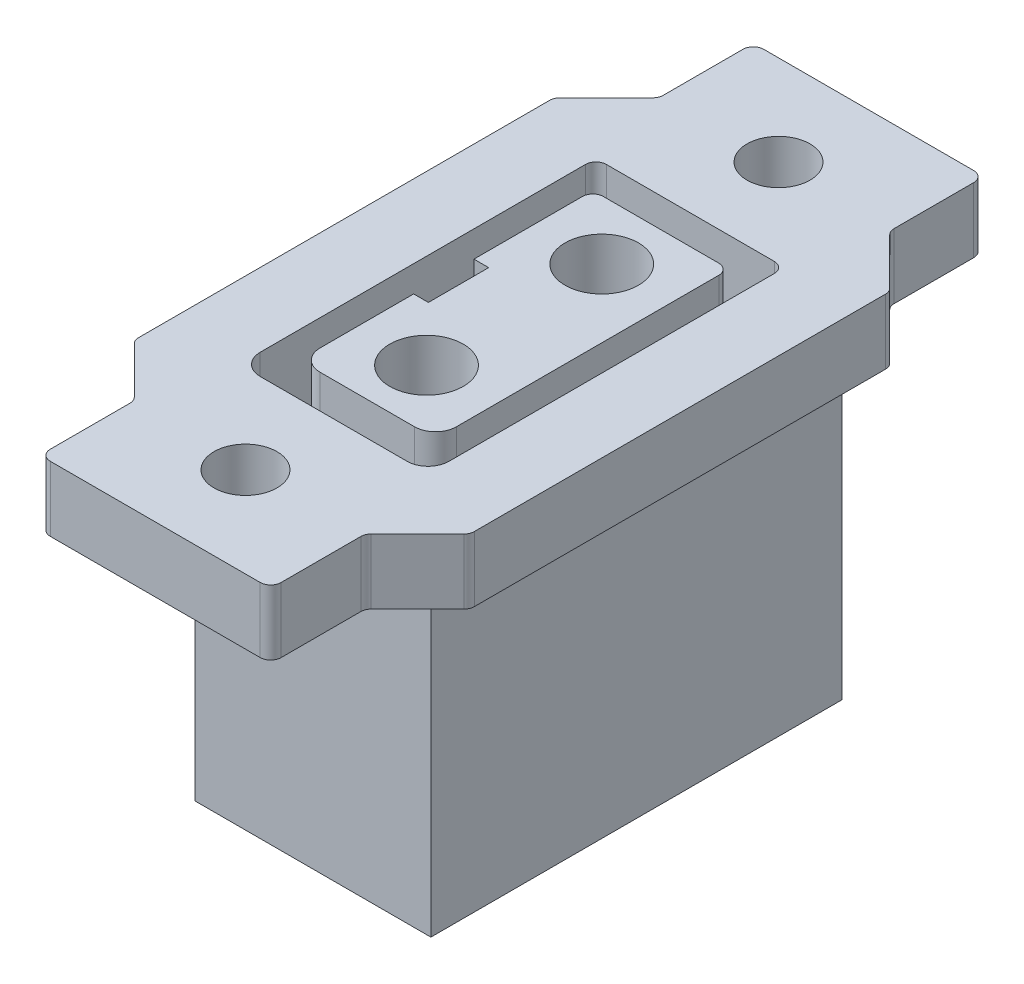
SolidWorks part; units mm, degrees
ref_plane "Front Plane" through (0, 0, 0) normal (0, 0, 1) x (1, 0, 0)
ref_plane "Top Plane" through (0, 0, 0) normal (0, 1, 0) x (1, 0, 0)
ref_plane "Right Plane" through (0, 0, 0) normal (1, 0, 0) x (0, 0, -1)
sketch "Sketch1" plane through (0, 0, 0) normal (0, 1, 0) x (1, 0, 0)
  line L0 (8, 34) -> (8, 29.7) construction
  line L7 (8, 0) -> (8, 4.3) construction
  line L8 (4.75, 24.1046) -> (4.75, 18.4368)
  line L9 (4.75, 18.4368) -> (5.4524, 18.4368)
  line L10 (5.4524, 18.4368) -> (5.4524, 15.5632)
  line L11 (5.4524, 15.5632) -> (4.75, 15.5632)
  line L12 (4.75, 15.5632) -> (4.75, 11.1025)
  line L13 (0, 34) -> (16, 34) construction
  line L14 (16, 0) -> (16, 34) construction
  line L15 (0, 0) -> (16, 0) construction
  line L20 (0, 0) -> (0, 34) construction
  line L21 (3.5, 25.5) -> (12.5, 25.5)
  line L22 (3.5, 25.5) -> (3.5, 9.5)
  line L23 (4.5, 8.5) -> (11.5, 8.5)
  line L24 (12.5, 25.5) -> (12.5, 9.5)
  line L25 (3.5, 25.5) -> (12.5, 8.5) construction
  line L26 (3.5, 8.5) -> (12.5, 25.5) construction
  line L28 (2.5, 29.5) -> (2.5, 34)
  line L29 (4.75, 24.1046) -> (11.25, 24.1046)
  line L31 (5.75, 10.1025) -> (10.25, 10.1025)
  line L32 (11.25, 24.1046) -> (11.25, 11.1025)
  line L33 (4.75, 24.1046) -> (11.25, 10.1025) construction
  line L34 (4.75, 10.1025) -> (11.25, 24.1046) construction
  line L35 (2.5, 34) -> (13.5, 34)
  line L36 (13.5, 34) -> (13.5, 29.5)
  line L37 (13.5, 29.5) -> (16, 27)
  line L40 (13.5, 4.5) -> (13.5, 0)
  line L41 (13.5, 0) -> (2.5, 0)
  line L42 (2.5, 0) -> (2.5, 4.5)
  line L46 (2.5, 29.5) -> (0, 27)
  line L47 (0, 27) -> (0, 7)
  line L48 (0, 7) -> (2.5, 4.5)
  line L49 (13.5, 4.5) -> (16, 7)
  line L50 (16, 7) -> (16, 27)
  circle A0 centre (8, 29.7) radius 1.5
  circle A1 centre (8, 4.3) radius 1.5
  circle A3 centre (8, 21.2778) radius 1.75
  circle A4 centre (8, 12.9262) radius 1.75
  arc A5 (3.5, 9.5) -> (4.5, 8.5) centre (4.5, 9.5) ccw
  arc A6 (11.5, 8.5) -> (12.5, 9.5) centre (11.5, 9.5) ccw
  arc A7 (10.25, 10.1025) -> (11.25, 11.1025) centre (10.25, 11.1025) ccw
  arc A8 (4.75, 11.1025) -> (5.75, 10.1025) centre (5.75, 11.1025) ccw
  point P0 (0, 0)
  point P1 (8, 0)
  point P4 (8, 17)
  point P22 (8, 24.1046)
  point P23 (8, 25.5)
  point P24 (5.4524, 17)
  point P33 (8, 17)
  point P42 (8, 17.1035)
  point P55 (8, 17)
  dimension "D3" = 3
  dimension "D4" = 9
  dimension "D6" = 3.5
  dimension "D10" = 1
  dimension "D11" = 1
  dimension "D12" = 1
  dimension "D13" = 1
  dimension "D2" = 34
  dimension "D5" = 6.5
  dimension "D7" = 2.8737
  dimension "D8" = 0.7024
  dimension "D9" = 4.3
  dimension "D15" = 4.5
  dimension "D16" = 7
  dimension "D17" = 45
  dimension "D14" = 16
extrude "Boss-Extrude2" add sketch "Sketch1" along normal blind 3.1
fillet "Fillet1" radius 0.5 12 edges at (0, 1.55, -7) (2.5, 1.55, -4.5) (2.5, 1.55, 0) (13.5, 1.55, 0) (13.5, 1.55, -4.5) (16, 1.55, -7) (16, 1.55, -27) (13.5, 1.55, -29.5) (13.5, 1.55, -34) (2.5, 1.55, -34) (0, 1.55, -27) (2.5, 1.55, -29.5)
sketch "Sketch4" plane through (0, 0, 0) normal (0, -1, 0) x (1, 0, 0)
  line L0 (5.75, -10.1025) -> (10.25, -10.1025) construction
  line L1 (13.6048, -27.1101) -> (2.3623, -27.1101)
  line L2 (13.6048, -27.1101) -> (13.6048, -7.53)
  line L3 (13.6048, -7.53) -> (2.3623, -7.53)
  line L4 (2.3623, -27.1101) -> (2.3623, -7.53)
  line L5 (13.6048, -27.1101) -> (2.3623, -7.53) construction
  line L6 (13.6048, -7.53) -> (2.3623, -27.1101) construction
  line L7 (4.5, -8.5) -> (11.5, -8.5) construction
  line L8 (5.75, -10.1025) -> (10.25, -10.1025)
  line L9 (4.5, -8.5) -> (11.5, -8.5)
  line L10 (4.75, -11.1025) -> (4.75, -15.5632) construction
  line L11 (4.75, -15.5632) -> (5.4524, -15.5632) construction
  line L12 (5.4524, -15.5632) -> (5.4524, -18.4368) construction
  line L13 (5.4524, -18.4368) -> (4.75, -18.4368) construction
  line L14 (4.75, -18.4368) -> (4.75, -24.1046) construction
  line L15 (4.75, -24.1046) -> (11.25, -24.1046) construction
  line L16 (11.25, -24.1046) -> (11.25, -11.1025) construction
  line L17 (10.25, -10.1025) -> (5.75, -10.1025) construction
  line L30 (4.75, -11.1025) -> (4.75, -15.5632)
  line L31 (4.75, -15.5632) -> (5.4524, -15.5632)
  line L32 (5.4524, -15.5632) -> (5.4524, -18.4368)
  line L33 (5.4524, -18.4368) -> (4.75, -18.4368)
  line L34 (4.75, -18.4368) -> (4.75, -24.1046)
  line L35 (4.75, -24.1046) -> (11.25, -24.1046)
  line L36 (11.25, -24.1046) -> (11.25, -11.1025)
  line L37 (10.25, -10.1025) -> (5.75, -10.1025)
  line L50 (3.5, -25.5) -> (3.5, -9.5) construction
  line L51 (3.5, -25.5) -> (12.5, -25.5) construction
  line L52 (12.5, -25.5) -> (12.5, -9.5) construction
  line L53 (3.5, -25.5) -> (3.5, -9.5)
  line L54 (3.5, -25.5) -> (12.5, -25.5)
  line L55 (12.5, -25.5) -> (12.5, -9.5)
  circle A0 centre (8, -21.2778) radius 1.75 construction
  circle A1 centre (8, -12.9262) radius 1.75 construction
  circle A2 centre (8, -21.2778) radius 1.75
  circle A3 centre (8, -12.9262) radius 1.75
  arc A4 (11.25, -11.1025) -> (10.25, -10.1025) centre (10.25, -11.1025) ccw construction
  arc A5 (5.75, -10.1025) -> (4.75, -11.1025) centre (5.75, -11.1025) ccw construction
  arc A18 (11.25, -11.1025) -> (10.25, -10.1025) centre (10.25, -11.1025) ccw
  arc A19 (5.75, -10.1025) -> (4.75, -11.1025) centre (5.75, -11.1025) ccw
  arc A32 (4.5, -8.5) -> (3.5, -9.5) centre (4.5, -9.5) ccw construction
  arc A33 (12.5, -9.5) -> (11.5, -8.5) centre (11.5, -9.5) ccw construction
  arc A34 (4.5, -8.5) -> (3.5, -9.5) centre (4.5, -9.5) ccw
  arc A35 (12.5, -9.5) -> (11.5, -8.5) centre (11.5, -9.5) ccw
  point P4 (7.9836, -17.32)
  point P5 (13.6048, -27.1101)
extrude "Boss-Extrude6" add sketch "Sketch4" along normal blind 10 contours L4 L1 L2 L3 M6 M1 M2 M3 M4 M5 | L8 A19 L30 L31 L32 L33 L34 L35 L36 A18 A2 A3
sketch "Sketch5" plane through (0, -10, 0) normal (0, -1, 0) x (1, 0, 0)
  line L4 (2.3623, -7.53) -> (2.3623, -27.1101)
  line L5 (2.3623, -27.1101) -> (13.6048, -27.1101)
  line L6 (13.6048, -27.1101) -> (13.6048, -7.53)
  line L7 (13.6048, -7.53) -> (2.3623, -7.53)
  line L8 (2.3623, -7.53) -> (2.3623, -27.1101)
  line L9 (2.3623, -27.1101) -> (13.6048, -27.1101)
  line L10 (13.6048, -27.1101) -> (13.6048, -7.53)
  line L11 (13.6048, -7.53) -> (2.3623, -7.53)
  dimension "D1" = 0
extrude "Boss-Extrude7" add sketch "Sketch5" along normal blind 5
fillet "Fillet2" radius 0.5 4 edges at (12.5, -3.45, -25.5) (11.25, -3.45, -24.1046) (4.75, -3.45, -24.1046) (3.5, -3.45, -25.5)
